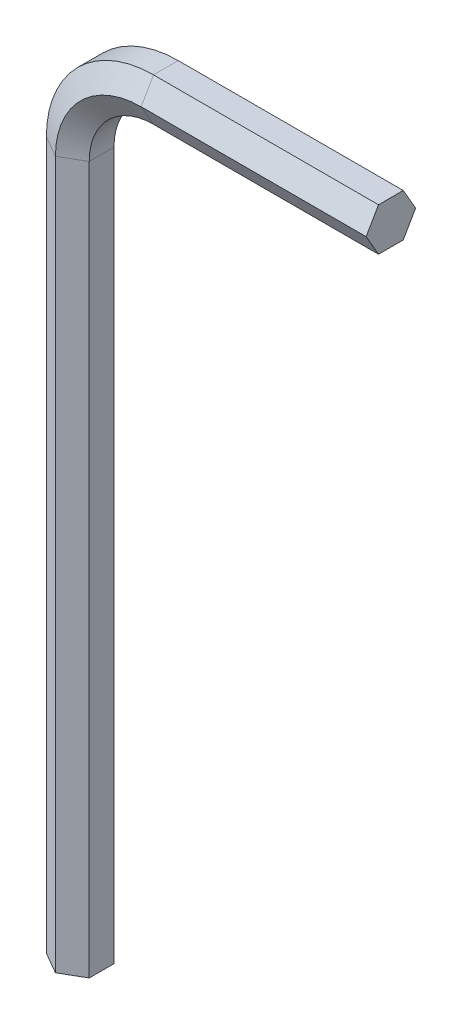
SolidWorks part; units mm, degrees
ref_plane "Alzado" through (0, 0, 0) normal (0, 0, 1) x (1, 0, 0)
ref_plane "Planta" through (0, 0, 0) normal (0, 1, 0) x (1, 0, 0)
ref_plane "Vista lateral" through (0, 0, 0) normal (1, 0, 0) x (0, 0, -1)
sketch "Croquis1" plane through (0, 0, 0) normal (0, 0, 1) x (1, 0, 0)
  line L0 (0, 0) -> (0, 66)
  line L1 (8, 74) -> (29, 74)
  arc A0 (0, 66) -> (8, 74) centre (8, 66) cw
  dimension "D3" = 8
  dimension "D1" = 74
  dimension "D2" = 29
ref_plane "Plano1" through (0, 0, 0) normal (0, 1, 0) x (1, 0, 0)
sketch "Croquis2" plane through (0, 0, 0) normal (0, 1, 0) x (1, 0, 0)
  line L1 (0, 2.3094) -> (-2, 1.1547)
  line L2 (-2, 1.1547) -> (-2, -1.1547)
  line L3 (-2, -1.1547) -> (0, -2.3094)
  line L4 (0, -2.3094) -> (2, -1.1547)
  line L5 (2, -1.1547) -> (2, 1.1547)
  line L6 (2, 1.1547) -> (0, 2.3094)
  circle A0 centre (0, 0) radius 2 construction
  dimension "D1" = 4
sweep "Barrer1" add profiles "Croquis2" path "Croquis1"
